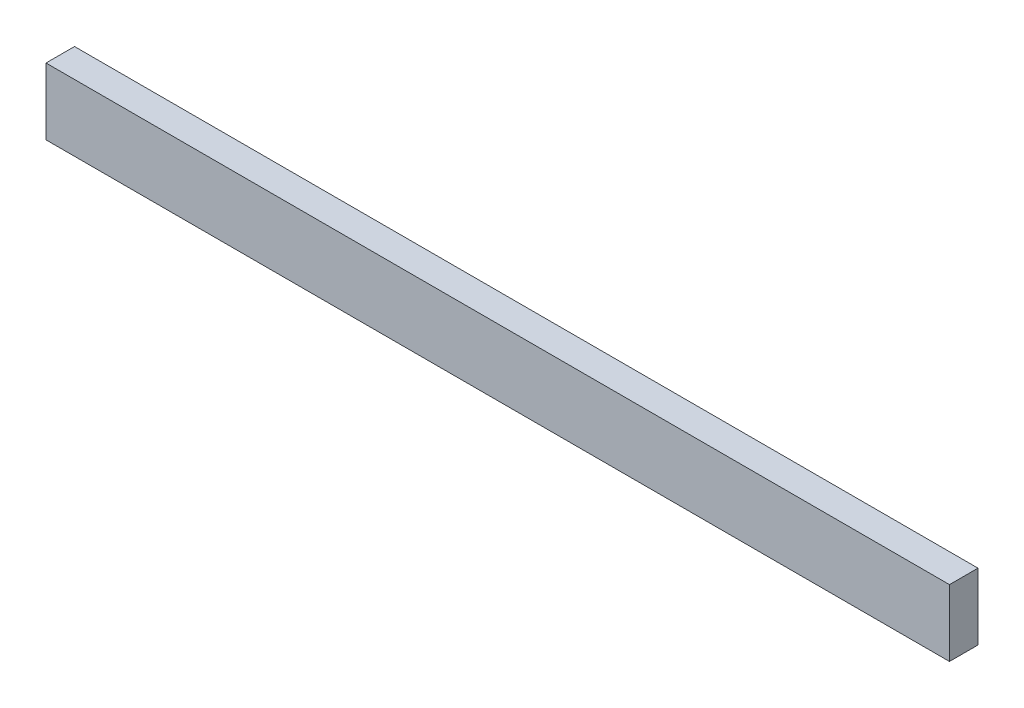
SolidWorks part; units mm, degrees
ref_plane "Plan de face" through (0, 0, 0) normal (0, 0, 1) x (1, 0, 0)
ref_plane "Plan de dessus" through (0, 0, 0) normal (0, 1, 0) x (1, 0, 0)
ref_plane "Plan de droite" through (0, 0, 0) normal (1, 0, 0) x (0, 0, -1)
sketch "Esquisse1" plane through (0, 0, 0) normal (0, 0, 1) x (1, 0, 0)
  line L1 (0, 0) -> (190, 0)
  line L2 (0, 0) -> (0, 14)
  line L3 (0, 14) -> (190, 14)
  line L4 (190, 0) -> (190, 14)
extrude "Boss.-Extru.1" add sketch "Esquisse1" along normal blind 6
